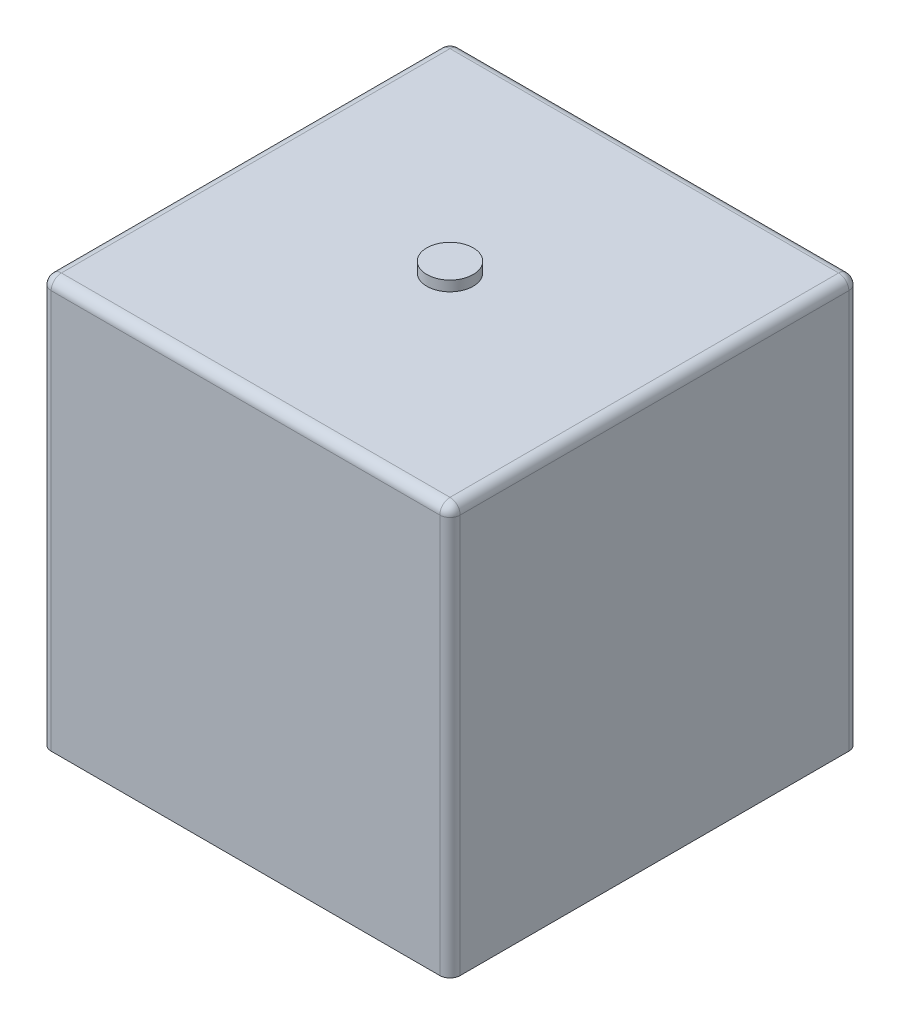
SolidWorks part; units mm, degrees
ref_plane "Front Plane" through (0, 0, 0) normal (0, 0, 1) x (1, 0, 0)
ref_plane "Top Plane" through (0, 0, 0) normal (0, 1, 0) x (1, 0, 0)
ref_plane "Right Plane" through (0, 0, 0) normal (1, 0, 0) x (0, 0, -1)
sketch "Sketch1" plane through (0, 0, 0) normal (0, 0, 1) x (1, 0, 0)
  line L1 (0, 0) -> (20, 0)
  line L2 (0, 0) -> (0, 20)
  line L3 (0, 20) -> (20, 20)
  line L4 (20, 0) -> (20, 20)
  dimension "D1" = 20
  dimension "D2" = 20
extrude "Boss-Extrude1" add sketch "Sketch1" along normal blind 20
sketch "Sketch2" plane through (0, 20, 0) normal (0, 1, 0) x (1, 0, 0)
  line L0 (10, 0) -> (10, -20) construction
  line L1 (20, 0) -> (0, 0) construction
  line L2 (20, -20) -> (0, -20) construction
  circle A0 centre (10, -10) radius 1.1315
extrude "Boss-Extrude2" add sketch "Sketch2" along normal blind 0.5
fillet "Fillet1" radius 0.5 8 edges at (0, 10, 0) (20, 10, 0) (20, 10, 20) (20, 20, 10) (10, 20, 0) (10, 20, 20) (0, 20, 10) (0, 10, 20)
